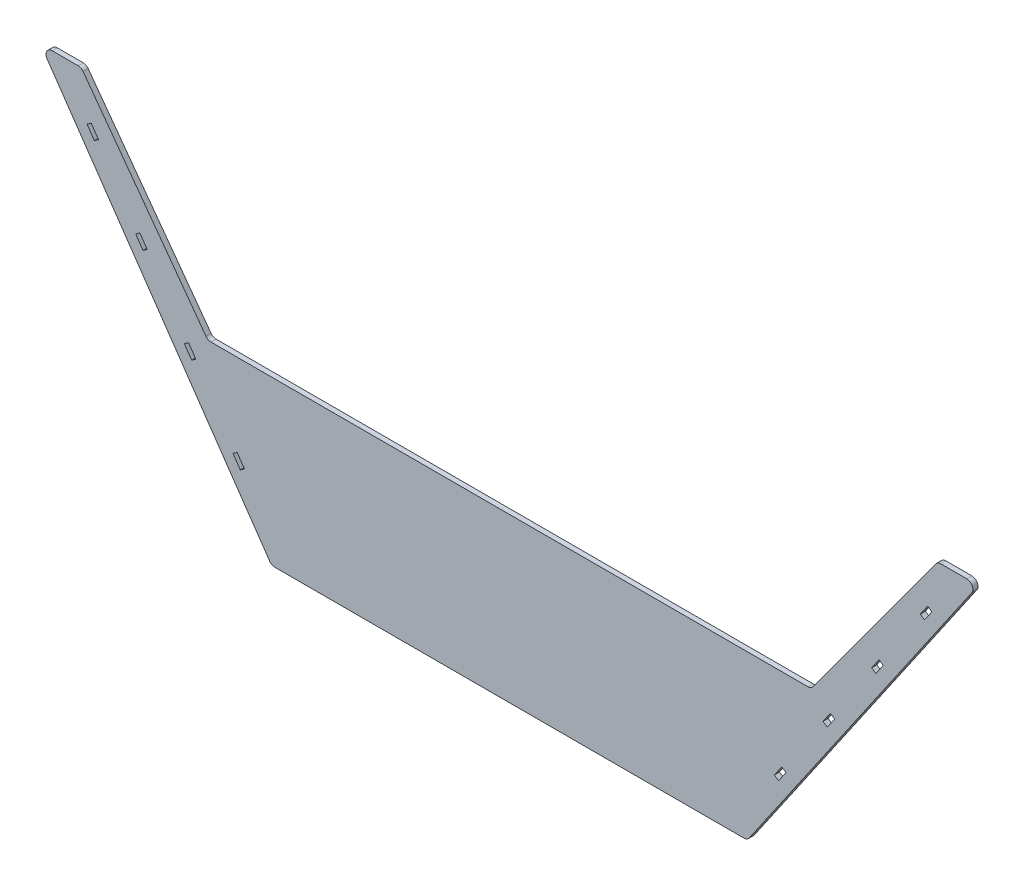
SolidWorks part; units mm, degrees
ref_plane "Front" through (0, 0, 0) normal (0, 0, 1) x (1, 0, 0)
ref_plane "Top" through (0, 0, 0) normal (0, 1, 0) x (1, 0, 0)
ref_plane "Right" through (0, 0, 0) normal (1, 0, 0) x (0, 0, -1)
sketch "草图1" plane through (0, 0, 0) normal (0, 0, 1) x (1, 0, 0)
  line L1 (-562.5341, 35.2119) -> (-675.8694, 200)
  line L2 (-675.8694, 200) -> (-655.8694, 200)
  line L4 (-653.0301, 177.38) -> (-649.4487, 172.1727)
  line L5 (-653.0301, 177.38) -> (-650.9702, 178.7967)
  line L6 (-649.4487, 172.1727) -> (-647.3888, 173.5894)
  line L7 (-650.9702, 178.7967) -> (-647.3888, 173.5894)
  line L8 (-629.173, 142.6921) -> (-625.5916, 137.4848)
  line L9 (-629.173, 142.6921) -> (-627.1132, 144.1088)
  line L10 (-625.5916, 137.4848) -> (-623.5318, 138.9015)
  line L11 (-627.1132, 144.1088) -> (-623.5318, 138.9015)
  line L12 (-605.3159, 108.0042) -> (-601.7345, 102.7969)
  line L13 (-605.3159, 108.0042) -> (-603.2561, 109.4209)
  line L14 (-601.7345, 102.7969) -> (-599.6747, 104.2136)
  line L15 (-603.2561, 109.4209) -> (-599.6747, 104.2136)
  line L16 (-581.4588, 73.3164) -> (-577.8774, 68.1091)
  line L17 (-581.4588, 73.3164) -> (-579.399, 74.733)
  line L18 (-577.8774, 68.1091) -> (-575.8176, 69.5257)
  line L19 (-579.399, 74.733) -> (-575.8176, 69.5257)
  line L20 (-562.5341, 35.2119) -> (-329.2047, 35.2119)
  line L38 (-593.7842, 115.2119) -> (-297.9545, 115.2119)
  line L39 (-655.8694, 200) -> (-593.7842, 115.2119)
  line L40 (-235.8694, 200) -> (-297.9545, 115.2119)
  line L41 (-312.3398, 74.733) -> (-315.9212, 69.5257)
  line L42 (-313.8613, 68.1091) -> (-315.9212, 69.5257)
  line L43 (-310.2799, 73.3164) -> (-312.3398, 74.733)
  line L44 (-310.2799, 73.3164) -> (-313.8613, 68.1091)
  line L45 (-288.4827, 109.4209) -> (-292.0641, 104.2136)
  line L46 (-290.0042, 102.7969) -> (-292.0641, 104.2136)
  line L47 (-286.4228, 108.0042) -> (-288.4827, 109.4209)
  line L48 (-286.4228, 108.0042) -> (-290.0042, 102.7969)
  line L49 (-264.6256, 144.1088) -> (-268.207, 138.9015)
  line L50 (-266.1471, 137.4848) -> (-268.207, 138.9015)
  line L51 (-262.5658, 142.6921) -> (-264.6256, 144.1088)
  line L52 (-262.5658, 142.6921) -> (-266.1471, 137.4848)
  line L53 (-240.7685, 178.7967) -> (-244.3499, 173.5894)
  line L54 (-242.2901, 172.1727) -> (-244.3499, 173.5894)
  line L55 (-238.7087, 177.38) -> (-240.7685, 178.7967)
  line L56 (-238.7087, 177.38) -> (-242.2901, 172.1727)
  line L57 (-329.2047, 35.2119) -> (-215.8694, 200)
  line L58 (-235.8694, 200) -> (-215.8694, 200)
  point P3 (-657.9737, 173.98)
  point P6 (-654.3923, 168.7727)
  point P7 (-562.5341, 35.2119)
  point P10 (-582.8211, 64.709)
  point P11 (-630.5353, 134.0848)
  point P18 (-606.6782, 99.3969)
  point P30 (-445.8694, 115.2119)
  point P47 (-285.0606, 99.3969)
  point P48 (-261.2035, 134.0848)
  point P49 (-308.9177, 64.709)
  point P50 (-237.3464, 168.7727)
  point P52 (-233.765, 173.98)
  dimension "D2" = 31.58
  dimension "D3" = 6.32
  dimension "D4" = 6.32
  dimension "D5" = 2.5
  dimension "D6" = 6
  dimension "D8" = 200
  dimension "D9" = 20
  dimension "D10" = 80
  dimension "D7" = 4
extrude "凸台-拉伸1" add sketch "草图1" along normal blind 2.5
fillet "圆角2" radius 3 8 edges at (-329.2047, 35.2119, 1.25) (-562.5341, 35.2119, 1.25) (-215.8694, 200, 1.25) (-235.8694, 200, 1.25) (-297.9545, 115.2119, 1.25) (-593.7842, 115.2119, 1.25) (-675.8694, 200, 1.25) (-655.8694, 200, 1.25)
